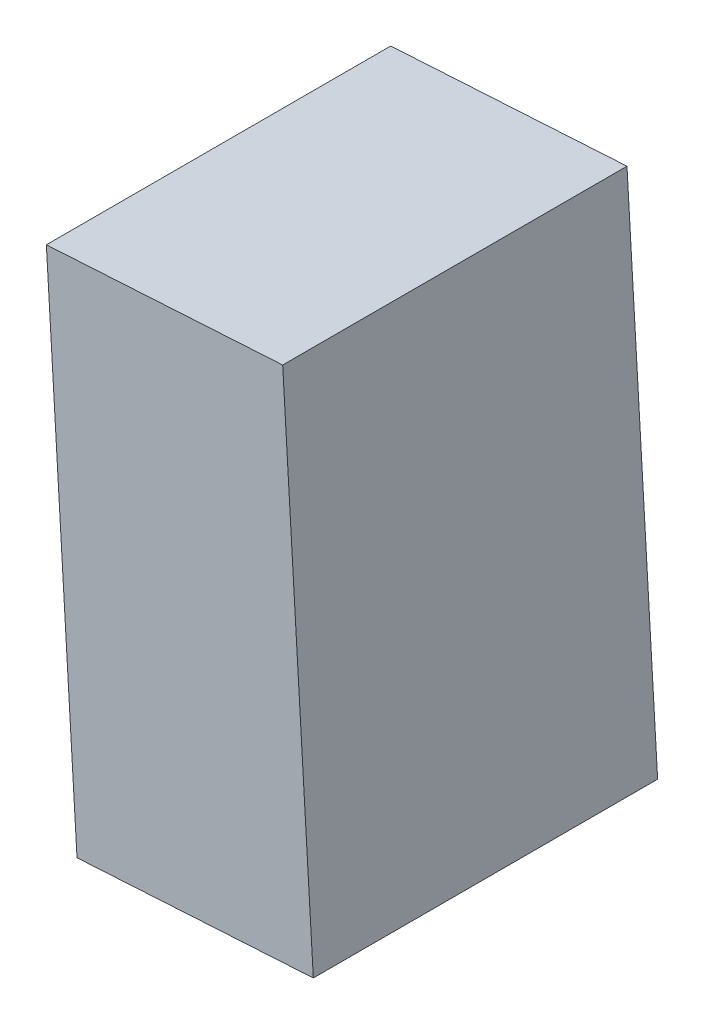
SolidWorks part; units mm, degrees
ref_plane "Front Plane" through (0, 0, 0) normal (0, 0, 1) x (1, 0, 0)
ref_plane "Top Plane" through (0, 0, 0) normal (0, 1, 0) x (1, 0, 0)
ref_plane "Right Plane" through (0, 0, 0) normal (1, 0, 0) x (0, 0, -1)
sketch "Sketch1" plane through (0, 0, 0) normal (0, 0, 1) x (1, 0, 0)
  line L0 (-484.3048, -558.7366) -> (-520.4711, 49.7896)
  line L1 (-520.4711, 49.7896) -> (-799.3789, 33.2134)
  line L2 (-799.3789, 33.2134) -> (-763.2126, -575.3129)
  line L3 (-763.2126, -575.3129) -> (-484.3048, -558.7366)
  line L4 (-77.4116, 578.7825) -> (-78.9518, 604.6968) construction
  dimension "D1" = 609.6
  dimension "D2" = 279.4
extrude "Boss-Extrude1" add sketch "Sketch1" against normal blind 406.4
